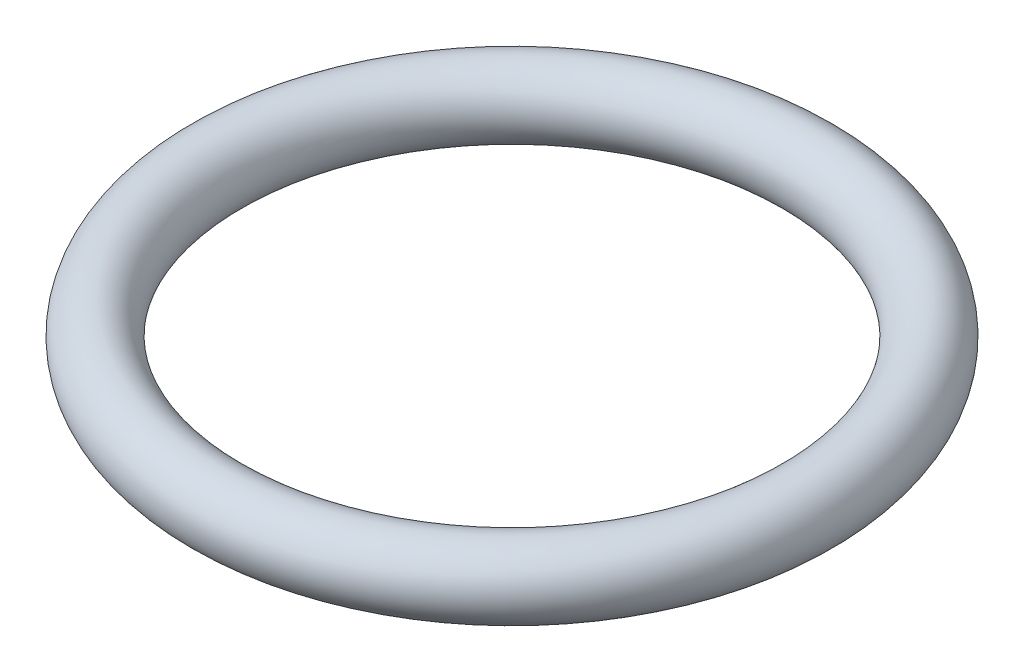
SolidWorks part; units mm, degrees
ref_plane "Plan de face" through (0, 0, 0) normal (0, 0, 1) x (1, 0, 0)
ref_plane "Plan de dessus" through (0, 0, 0) normal (0, 1, 0) x (1, 0, 0)
ref_plane "Plan de droite" through (0, 0, 0) normal (1, 0, 0) x (0, 0, -1)
sketch "Esquisse1" plane through (0, 0, 0) normal (0, 0, 1) x (1, 0, 0)
  line L0 (0, 0) -> (0, 5.5885) construction
  circle A0 centre (8.5, 0) radius 1
  dimension "D1" = 2
  dimension "D2" = 8.5
revolve "Révolution1" add sketch "Esquisse1" angle 360 about L0
